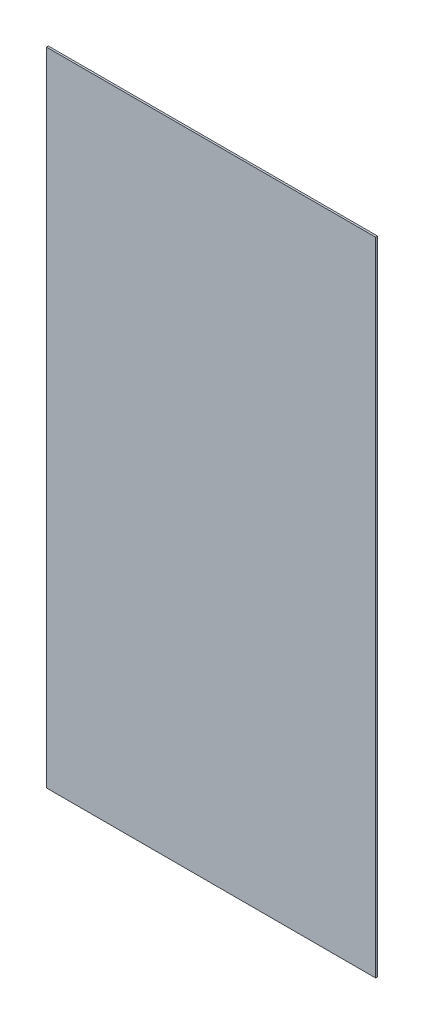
SolidWorks part; units mm, degrees
ref_plane "Plano frontal" through (0, 0, 0) normal (0, 0, 1) x (1, 0, 0)
ref_plane "Plano superior" through (0, 0, 0) normal (0, 1, 0) x (1, 0, 0)
ref_plane "Plano direito" through (0, 0, 0) normal (1, 0, 0) x (0, 0, -1)
sketch "Esboço1" plane through (0, 0, 0) normal (0, 0, 1) x (1, 0, 0)
  line L1 (0, 1000) -> (1026, 1000)
  line L2 (0, 1000) -> (0, -1000)
  line L3 (0, -1000) -> (1026, -1000)
  line L4 (1026, 1000) -> (1026, -1000)
  line L5 (0, 1000) -> (1026, -1000) construction
  line L6 (0, -1000) -> (1026, 1000) construction
  point P4 (513, 0)
extrude "Ressalto-extrusão1" add sketch "Esboço1" along normal blind 6
